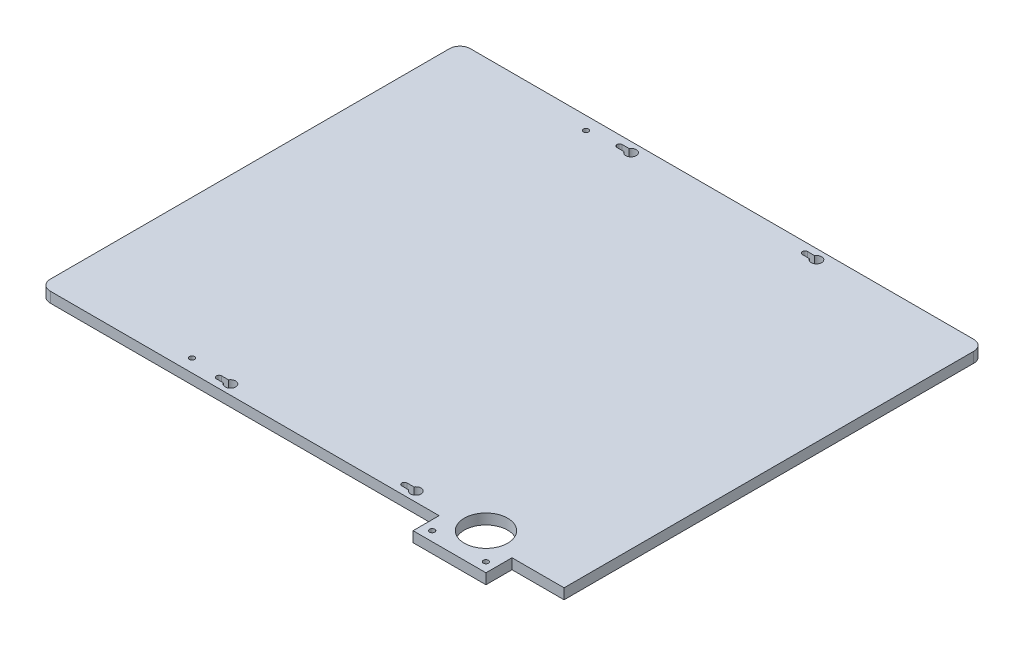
SolidWorks part; units mm, degrees
ref_plane "Front" through (0, 0, 0) normal (0, 0, 1) x (1, 0, 0)
ref_plane "Top" through (0, 0, 0) normal (0, 1, 0) x (1, 0, 0)
ref_plane "Right" through (0, 0, 0) normal (1, 0, 0) x (0, 0, -1)
ref_plane "Plane1" through (0, 3, 0) normal (0, 1, 0) x (1, 0, 0)
sketch "Sketch1" plane through (0, 3, 0) normal (0, 1, 0) x (1, 0, 0)
  line L0 (-151, -121) -> (151, -121)
  line L1 (-151, 121) -> (-151, -121)
  line L2 (151, 121) -> (-151, 121)
  line L3 (151, 121) -> (151, -121)
  line L5 (121, -94) -> (79, -94)
  line L6 (121, -94) -> (121, -136)
  line L7 (121, -136) -> (79, -136)
  line L8 (79, -94) -> (79, -136)
  circle A0 centre (100, -115) radius 12.5
  circle A1 centre (84.5, -130.5) radius 1.5
  circle A2 centre (115.5, -130.5) radius 1.5
  circle A3 centre (-70.85, -113.5) radius 1.5
  circle A4 centre (-70.85, 113.5) radius 1.5
  dimension "D9" = 25
  dimension "D10" = 3
  dimension "D11" = 3
  dimension "D17" = 3
  dimension "D18" = 7.5
  dimension "D19" = 3
  dimension "D2" = 121
  dimension "D3" = 302
  dimension "D4" = 121
  dimension "D5" = 42
  dimension "D6" = 42
  dimension "D8" = 21
  dimension "D12" = 31
  dimension "D13" = 5.5
  dimension "D20" = 7.5
extrude "Boss-Extrude1" add sketch "Sketch1" against normal blind 6 contours L0 L8 L7 L6 A2 A1 | L5 L8 L0 L3 A0 | L8 L5 L3 L2 L1 L0
sketch "Sketch2" plane through (0, -3, 0) normal (0, 1, 0) x (-1, 0, 0)
  line L0 (-57.4019, -116.9) -> (-53.4, -116.9)
  line L1 (-53.4, -113.9) -> (-57.4019, -113.9)
  arc A0 (-57.4019, -113.9) -> (-57.4019, -116.9) centre (-60, -115.4) cw
  arc A1 (-53.4, -116.9) -> (-53.4, -113.9) centre (-53.4, -115.4) ccw
extrude "Cut-Extrude1" cut sketch "Sketch2" along normal through all
sketch "Sketch3" plane through (0, -3, 0) normal (0, 1, 0) x (-1, 0, 0)
  line L0 (49.3981, -116.9) -> (53.4, -116.9)
  line L1 (53.4, -113.9) -> (49.3981, -113.9)
  arc A0 (49.3981, -113.9) -> (49.3981, -116.9) centre (46.8, -115.4) cw
  arc A1 (53.4, -116.9) -> (53.4, -113.9) centre (53.4, -115.4) ccw
extrude "Cut-Extrude2" cut sketch "Sketch3" along normal through all
sketch "Sketch4" plane through (0, -3, 0) normal (0, 1, 0) x (-1, 0, 0)
  line L0 (-57.4019, 113.9) -> (-53.4, 113.9)
  line L1 (-53.4, 116.9) -> (-57.4019, 116.9)
  arc A0 (-57.4019, 116.9) -> (-57.4019, 113.9) centre (-60, 115.4) cw
  arc A1 (-53.4, 113.9) -> (-53.4, 116.9) centre (-53.4, 115.4) ccw
extrude "Cut-Extrude3" cut sketch "Sketch4" along normal through all
sketch "Sketch5" plane through (0, 3, 0) normal (0, -1, 0) x (1, 0, 0)
  line L0 (-53.4, 113.9) -> (-49.3981, 113.9)
  line L1 (-49.3981, 116.9) -> (-53.4, 116.9)
  arc A0 (-53.4, 116.9) -> (-53.4, 113.9) centre (-53.4, 115.4) ccw
  arc A1 (-49.3981, 113.9) -> (-49.3981, 116.9) centre (-46.8, 115.4) cw
extrude "Cut-Extrude4" cut sketch "Sketch5" along normal through all
ref_plane "Plane2" through (0, 0, -115.4) normal (0, 0, 1) x (1, 0, 0)
sketch "Sketch6" plane through (0, 0, -115.4) normal (0, 0, 1) x (1, 0, 0)
  line L0 (63, 3) -> (60, 3)
  line L1 (60, 3) -> (60, -3)
  line L2 (60, -3) -> (63, -3)
  line L3 (63, -3) -> (63, 3)
  line L4 (60, 3) -> (60, -3) construction
revolve "Cut-Revolve1" cut sketch "Sketch6" angle 360 about L4
sketch "Sketch7" plane through (0, 0, -115.4) normal (0, 0, 1) x (1, 0, 0)
  line L0 (-43.8, 3) -> (-46.8, 3)
  line L1 (-46.8, 3) -> (-46.8, -3)
  line L2 (-46.8, -3) -> (-43.8, -3)
  line L3 (-43.8, -3) -> (-43.8, 3)
  line L4 (-46.8, 3) -> (-46.8, -3) construction
revolve "Cut-Revolve2" cut sketch "Sketch7" angle 360 about L4
ref_plane "Plane3" through (0, 0, 115.4) normal (0, 0, 1) x (1, 0, 0)
sketch "Sketch8" plane through (0, 0, 115.4) normal (0, 0, 1) x (1, 0, 0)
  line L0 (63, 3) -> (60, 3)
  line L1 (60, 3) -> (60, -3)
  line L2 (60, -3) -> (63, -3)
  line L3 (63, -3) -> (63, 3)
  line L4 (60, 3) -> (60, -3) construction
revolve "Cut-Revolve3" cut sketch "Sketch8" angle 360 about L4
sketch "Sketch9" plane through (0, 0, 115.4) normal (0, 0, 1) x (1, 0, 0)
  line L0 (-43.8, 3) -> (-46.8, 3)
  line L1 (-46.8, 3) -> (-46.8, -3)
  line L2 (-46.8, -3) -> (-43.8, -3)
  line L3 (-43.8, -3) -> (-43.8, 3)
  line L4 (-46.8, 3) -> (-46.8, -3) construction
revolve "Cut-Revolve4" cut sketch "Sketch9" angle 360 about L4
fillet "Fillet1" radius 6 3 edges at (-151, 0, 121) (-151, 0, -121) (151, 0, -121)
